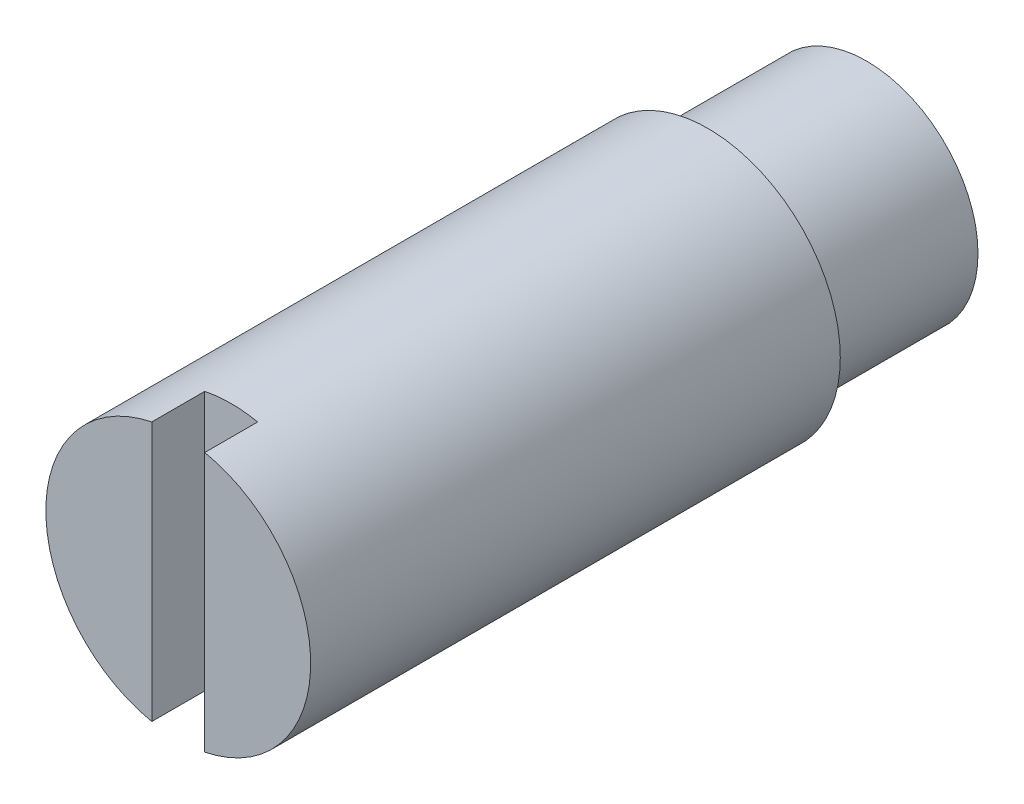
SolidWorks part; units mm, degrees
ref_plane "Front Plane" through (0, 0, 0) normal (0, 0, 1) x (1, 0, 0)
ref_plane "Top Plane" through (0, 0, 0) normal (0, 1, 0) x (1, 0, 0)
ref_plane "Right Plane" through (0, 0, 0) normal (1, 0, 0) x (0, 0, -1)
sketch "Sketch1" plane through (0, 0, 0) normal (0, 0, 1) x (1, 0, 0)
  circle A0 centre (0, 0) radius 2.5
  dimension "D1" = 5
extrude "Extrude1" add sketch "Sketch1" along normal blind 13
sketch "Sketch2" plane through (0, 0, 0) normal (0, 0, 1) x (1, 0, 0)
  circle A0 centre (0, 0) radius 2.1
  circle A1 centre (0, 0) radius 3.8452
  dimension "D1" = 4.2
extrude "Extrude2" cut sketch "Sketch2" along normal blind 3
sketch "Sketch3" plane through (0, 0, 13) normal (0, 0, 1) x (1, 0, 0)
  line L0 (0, 2.5) -> (0, -2.5) construction
  line L1 (-0.5, 2.5) -> (-0.5, -2.5)
  line L2 (0.5, 2.5) -> (0.5, -2.5)
  line L3 (0.5, 2.5) -> (-0.5, 2.5)
  line L4 (-0.5, -2.5) -> (0.5, -2.5)
  circle A0 centre (0, 0) radius 2.5 construction
  dimension "D1" = 0.5
  dimension "D2" = 0.5
extrude "Extrude3" cut sketch "Sketch3" against normal blind 1
